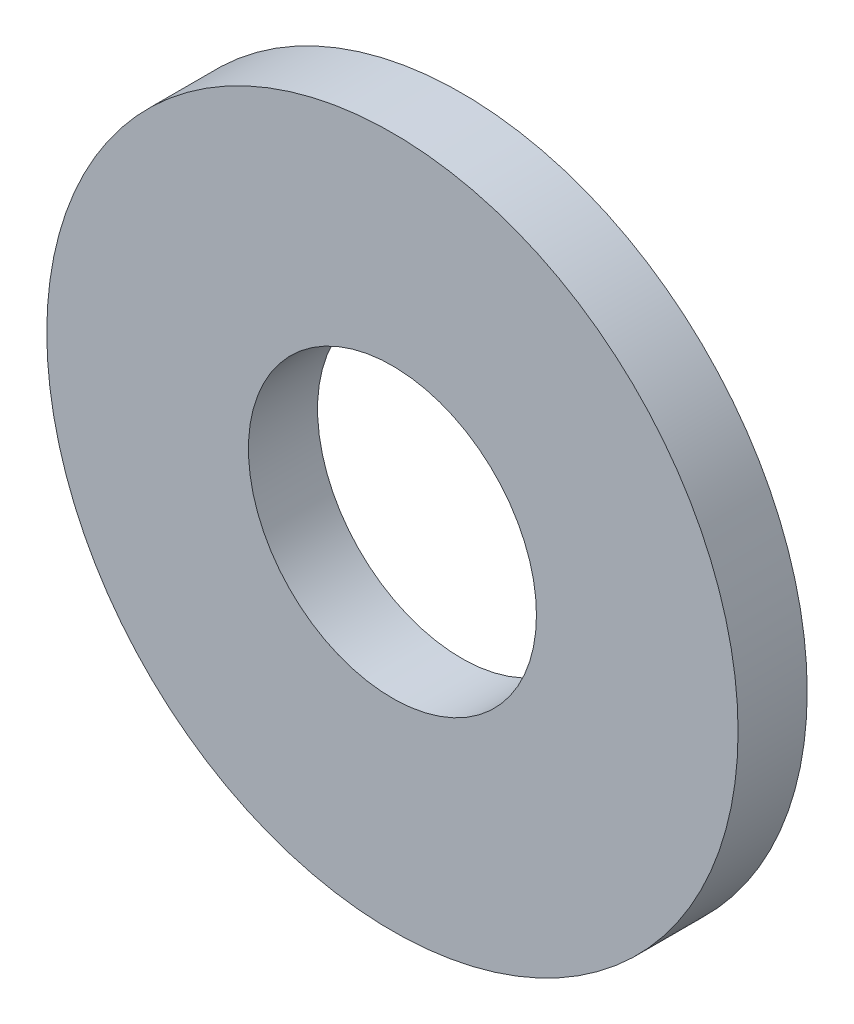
SolidWorks part; units mm, degrees
ref_plane "X_Y" through (0, 0, 0) normal (0, 0, 1) x (1, 0, 0)
ref_plane "Z_X" through (0, 0, 0) normal (0, 1, 0) x (1, 0, 0)
ref_plane "Y_Z" through (0, 0, 0) normal (1, 0, 0) x (0, 0, -1)
sketch "Sketch1" plane through (0, 0, 0) normal (0, 0, 1) x (1, 0, 0)
  circle A0 centre (0, 0) radius 1.25
  circle A1 centre (0, 0) radius 3
  dimension "D1" = 2.5
  dimension "D2" = 6
extrude "Boss-Extrude1" add sketch "Sketch1" along normal blind 0.6
